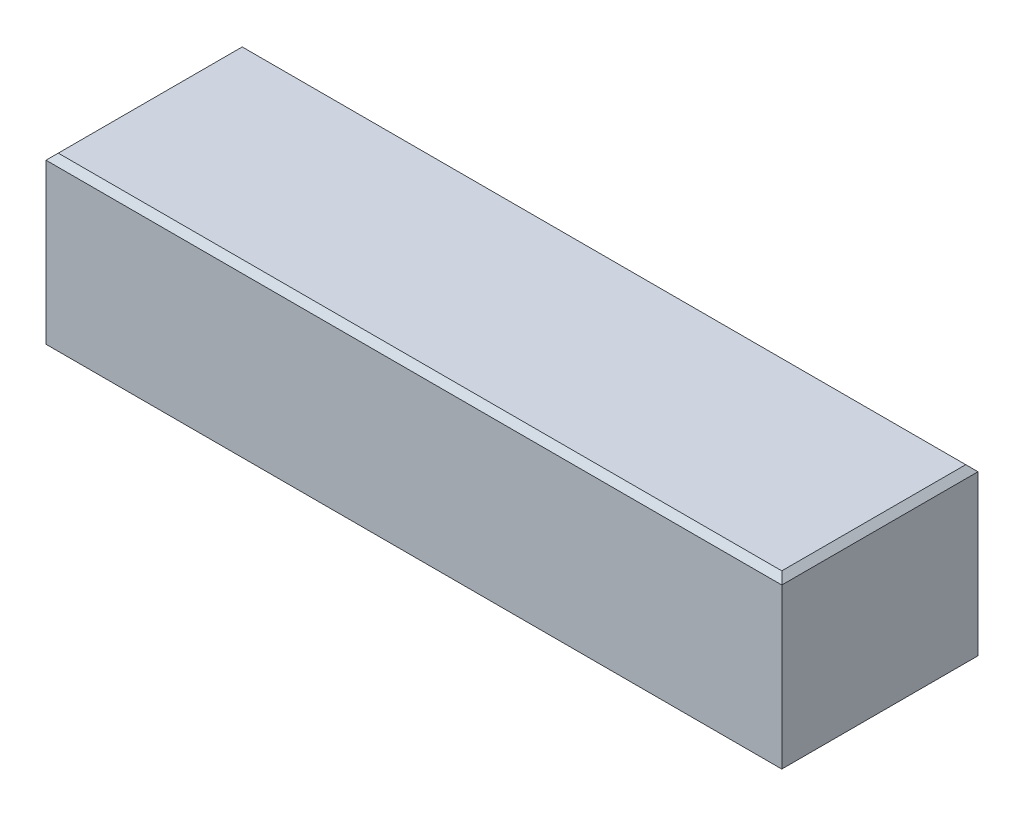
SolidWorks part; units mm, degrees
ref_plane "Plan1" through (0, 0, 0) normal (0, 0, 1) x (1, 0, 0)
ref_plane "Plan2" through (0, 0, 0) normal (0, 1, 0) x (1, 0, 0)
ref_plane "Plan3" through (0, 0, 0) normal (1, 0, 0) x (0, 0, -1)
sketch "Esquisse1" plane through (0, 0, 0) normal (0, 1, 0) x (1, 0, 0)
  line L0 (0, 0) -> (30, 0) construction
  line L1 (30, 4) -> (0, 4)
  line L2 (30, -4) -> (0, -4)
  line L3 (0, -4) -> (0, 4)
  line L4 (30, -4) -> (30, 4)
  dimension "a" = 8
  dimension "l" = 30
extrude "Base-Extrusion" add sketch "Esquisse1" along normal blind 7
chamfer "Chanfrein1" distance 0.25 angle 45 8 edges at (30, 7, 0) (15, 7, -4) (0, 7, 0) (15, 0, -4) (30, 0, 0) (15, 0, 4) (0, 0, 0) (15, 7, 4)
ref_plane "Plan-tangent-arbre" through (0, 4, 0) normal (0, 1, 0) x (-1, 0, 0)
sketch "Section-rainure-alesage" plane through (0, 0, 0) normal (1, 0, 0) x (0, 0, -1)
  line L0 (4, 7.3) -> (-4, 7.3) construction
  line L1 (50, 4) -> (-50, 4) construction
  line L2 (-4, 7.3) -> (-4, 4) construction
  line L3 (4, 4) -> (4, 7.3) construction
  line L4 (-4, 4) -> (4, 4) construction
  line L5 (-4, 6.75) -> (-4, 0.25) construction
  dimension "k-d" = 3.3
